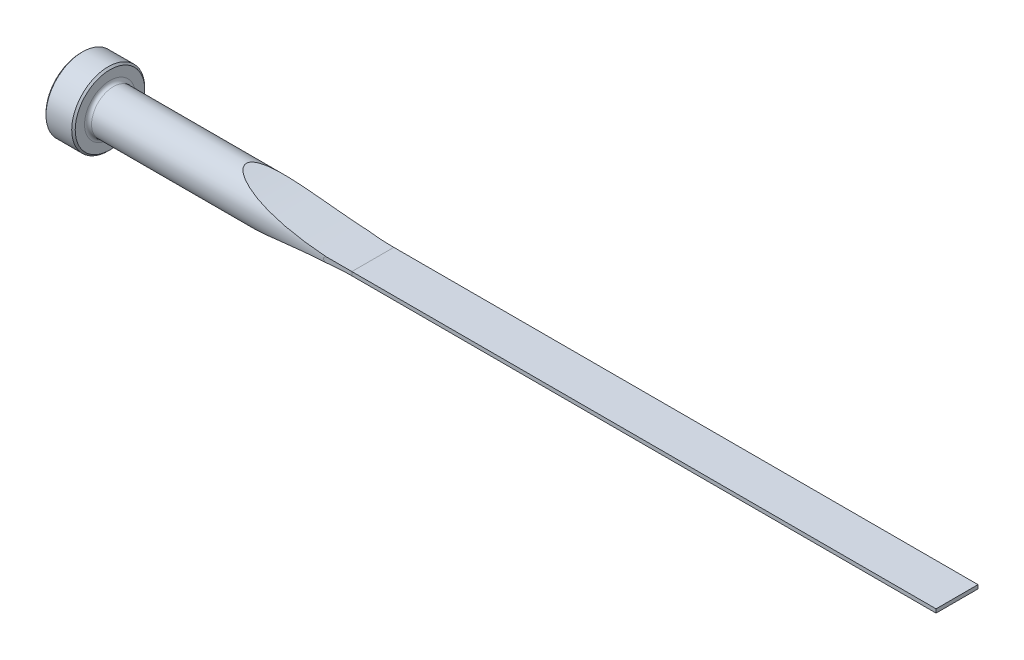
SolidWorks part; units mm, degrees
ref_plane "Front Plane" through (0, 0, 0) normal (0, 0, 1) x (1, 0, 0)
ref_plane "Top Plane" through (0, 0, 0) normal (0, 1, 0) x (1, 0, 0)
ref_plane "Right Plane" through (0, 0, 0) normal (1, 0, 0) x (0, 0, -1)
sketch "Sketch1" plane through (0, 0, 0) normal (0, 0, 1) x (1, 0, 0)
  line L0 (0, 0) -> (175.5286, 0) construction
  line L1 (0, 0) -> (0, 7.9375)
  line L2 (0, 7.9375) -> (6.35, 7.9375)
  line L3 (6.35, 7.9375) -> (6.35, 4.7625)
  line L4 (6.35, 4.7625) -> (190.5, 4.7625)
  line L5 (190.5, 4.7625) -> (190.5, 0)
  line L6 (190.5, 0) -> (0, 0)
  dimension "D1" = 190.5
  dimension "D2" = 15.875
  dimension "D3" = 9.525
  dimension "D4" = 6.35
revolve "Revolve1" add sketch "Sketch1" angle 360 about L0
sketch "Sketch2" plane through (0, 0, 0) normal (0, 0, 1) x (1, 0, 0)
  line L0 (190.5, 4.7625) -> (190.5, 0.4064)
  line L1 (190.5, -4.7625) -> (190.5, 4.7625) construction
  line L2 (190.5, 0.4064) -> (63.5, 0.4064)
  line L3 (190.5, 4.7625) -> (6.35, 4.7625) construction
  line L4 (36.0129, 4.7625) -> (190.5, 4.7625)
  line L5 (166.0833, 0) -> (153.1705, 0) construction
  arc A0 (63.5, 0.4064) -> (36.0129, 4.7625) centre (63.5, 89.3064) cw
  dimension "D1" = 88.9
  dimension "D3" = 127
  dimension "D2" = 0.8128
  dimension "D4" = 27.4871
extrude "Cut-Extrude1" cut sketch "Sketch2" against normal through all both and the other way through all
mirror "Mirror1" about plane through (0, 0, 0) normal (0, 1, 0) of "Cut-Extrude1"
sketch "Sketch3" plane through (0, 0, 0) normal (0, 1, 0) x (1, 0, 0)
  line L0 (190.5, 4.7625) -> (190.5, 4.5593)
  line L1 (190.5, 4.7451) -> (190.5, -4.7451) construction
  line L2 (190.5, 4.5593) -> (63.5, 4.5593)
  line L3 (190.5, 4.7625) -> (6.35, 4.7625) construction
  line L4 (57.4927, 4.7625) -> (190.5, 4.7625)
  line L5 (163.4716, 0) -> (166.2513, 0) construction
  line L6 (63.5, 4.7451) -> (63.5, -4.7451) construction
  arc A0 (63.5, 4.5593) -> (57.4927, 4.7625) centre (63.5, 93.4593) cw
  dimension "D2" = 88.9
  dimension "D1" = 9.1186
extrude "Cut-Extrude2" cut sketch "Sketch3" against normal through all both and the other way through all
mirror "Mirror2" about plane through (0, 0, 0) normal (0, 0, 1) of "Cut-Extrude2"
fillet "Fillet1" radius 0.762 1 edges at (6.35, 0, 4.7625)
chamfer "Chamfer1" distance 0.381 angle 45 2 edges at (0, 0, 7.9375) (6.35, 0, 7.9375)
